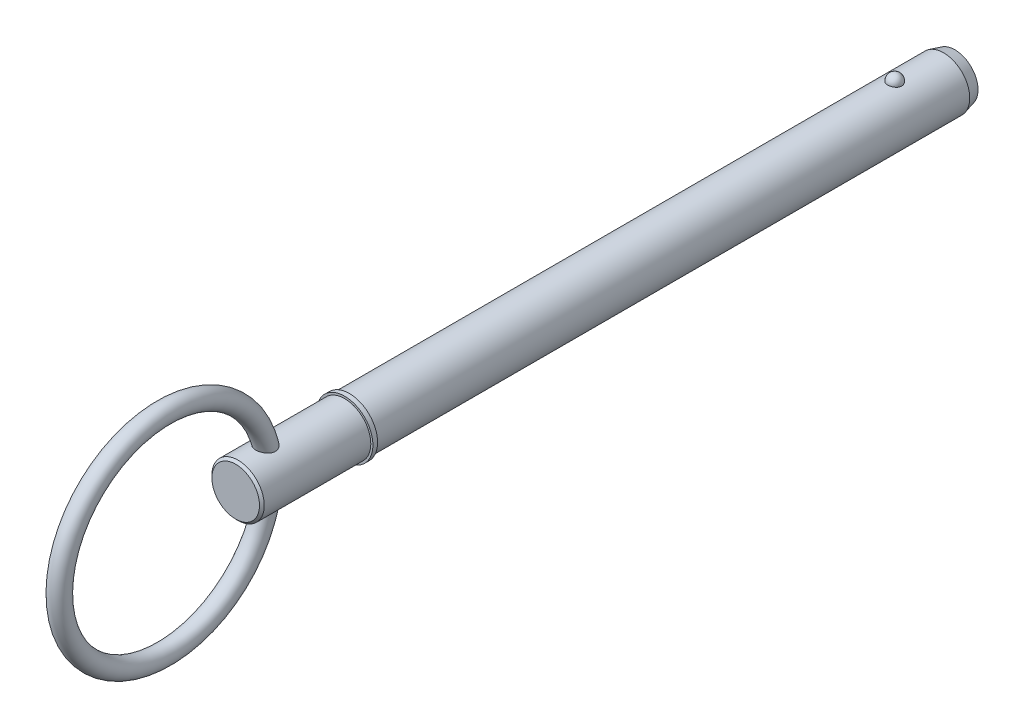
SolidWorks part; units mm, degrees
ref_plane "Front Plane" through (0, 0, 0) normal (0, 0, 1) x (1, 0, 0)
ref_plane "Top Plane" through (0, 0, 0) normal (0, 1, 0) x (1, 0, 0)
ref_plane "Right Plane" through (0, 0, 0) normal (1, 0, 0) x (0, 0, -1)
sketch "Sketch2" plane through (0, 0, 0) normal (0, 0, 1) x (1, 0, 0)
  circle A0 centre (0, 0) radius 5.555
  point P3 (0, 5.555)
  dimension "D1" = 11.11
extrude "Boss-Extrude1" add sketch "Sketch2" along normal blind 114.3
sketch "Sketch3" plane through (0, 0, 0) normal (0, 0, -1) x (-1, 0, 0)
  circle A0 centre (0, 0) radius 5.555
  dimension "D1" = 11.11
extrude "Boss-Extrude2" add sketch "Sketch3" along normal blind 14.27
chamfer "Chamfer1" distance 2.4 angle 15 1 edges at (-5.555, 0, -14.27)
sketch "Sketch18" plane through (0, 0, 0) normal (1, 0, 0) x (0, 0, -1)
  line L0 (11.87, 5.555) -> (-114.3, 5.555) construction
  line L1 (1.49, 7.045) -> (1.49, 4.065)
  line L2 (-114.3, -5.555) -> (11.87, -5.555) construction
  arc A0 (1.49, 7.045) -> (1.49, 4.065) centre (1.49, 5.555) ccw
  point P4 (0, 5.555)
  dimension "D1" = 12.6
revolve "Revolve1" add sketch "Sketch18" angle 360 about L1
sketch "Sketch19" plane through (0, 0, 0) normal (1, 0, 0) x (0, 0, -1)
  line L0 (-33.7288, 0) -> (-46.4542, 0) construction
sketch "Sketch20" plane through (0, 0, 0) normal (1, 0, 0) x (0, 0, -1)
  line L0 (-114.3, 0) -> (-114.3, 6)
  line L1 (-114.3, 5.555) -> (-114.3, -5.555) construction
  line L2 (-114.3, 6) -> (-115.3, 6)
  line L3 (-115.3, 6) -> (-115.3, 0)
  line L4 (-33.7288, 0) -> (-46.4542, 0) construction
  line L5 (-115.3, 0) -> (-114.3, 0)
  dimension "D1" = 6
  dimension "D2" = 1
revolve "Revolve2" add sketch "Sketch20" angle 360 about L0
sketch "Sketch21" plane through (0, 0, 114.3) normal (0, 0, -1) x (-1, 0, 0)
  circle A0 centre (0, 0) radius 5.555
  dimension "D1" = 11.11
extrude "Boss-Extrude3" add sketch "Sketch21" against normal blind 24.13
chamfer "Chamfer2" distance 0.5 angle 45 1 edges at (-5.555, 0, 138.43)
sketch "Sketch23" plane through (0, 0, 0) normal (1, 0, 0) x (0, 0, -1)
  line L0 (-138.43, 5.055) -> (-138.43, -5.055) construction
  circle A0 centre (-153.655, 0) radius 22.225
  point P2 (-131.43, 0)
  dimension "D1" = 44.45
  dimension "D2" = 7
sketch "Sketch24" plane through (0, 0, 0) normal (0, 1, 0) x (1, 0, 0)
  circle A0 centre (0, -131.43) radius 2
  dimension "D1" = 4
sweep "Sweep1" add profiles "Sketch24" path "Sketch23"
